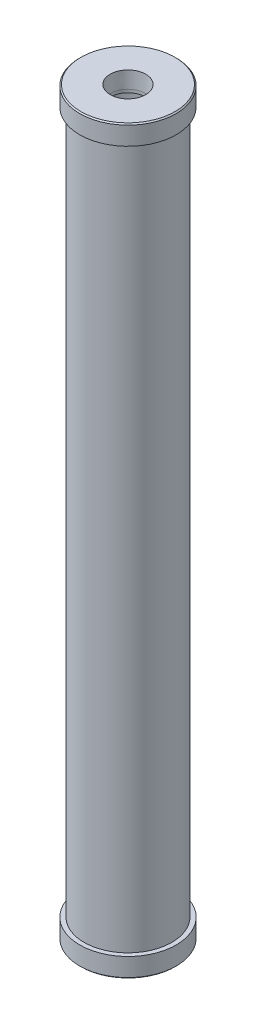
SolidWorks part; units mm, degrees
ref_plane "Front Plane" through (0, 0, 0) normal (0, 0, 1) x (1, 0, 0)
ref_plane "Top Plane" through (0, 0, 0) normal (0, 1, 0) x (1, 0, 0)
ref_plane "Right Plane" through (0, 0, 0) normal (1, 0, 0) x (0, 0, -1)
sketch "Sketch1" plane through (0, 0, 0) normal (0, 1, 0) x (1, 0, 0)
  circle A0 centre (0, 0) radius 57.15
  circle A1 centre (0, 0) radius 50.546
  dimension "D1" = 114.3
  dimension "D2" = 6.604
extrude "Boss-Extrude1" add sketch "Sketch1" along normal blind 965.2
sketch "Sketch2" plane through (0, 0, 0) normal (0, 1, 0) x (1, 0, 0)
  circle A0 centre (0, 0) radius 62.865
  dimension "D1" = 125.73
extrude "Boss-Extrude2" add sketch "Sketch2" along normal blind 25.4
hole_wizard "1-1/2 Rc Tapped Hole1" positions "Sketch4" profile "Sketch3" size "1-1/2" standard "BSI"
sketch "Sketch4" plane through (0, 0, 0) normal (0, 1, 0) x (1, 0, 0)
  point P0 (0, 0)
sketch "Sketch3" plane through (0, 0, 0) normal (1, 0, 0) x (0, 0, -1)
  line L0 (0, 0) -> (0, 46.3454)
  line L1 (22.6, 32.766) -> (0, 46.3454)
  line L2 (-22.6, 32.766) -> (0, 46.3454) construction
  line L3 (22.6, 32.766) -> (22.6, 21.336)
  line L4 (22.6, 21.336) -> (22.494, 21.336)
  line L5 (22.494, 21.336) -> (23.16, 0)
  line L6 (-22.494, 21.336) -> (-23.16, 0) construction
  line L7 (23.16, 0) -> (0, 0)
  line L8 (0, -6.35) -> (0, 107.95) construction
  line L11 (-22.6, 21.336) -> (-22.494, 21.336) construction
  dimension "Tap Drill Dia." = 45.2
  dimension "Tap Drill Depth" = 32.766
  dimension "Thread Dia." = 46.32
  dimension "Thread Angle" = 3.576
  dimension "Thread Depth" = 21.336
  dimension "Drill Angle" = 118
ref_plane "Plane1" through (0, 965.2, 0) normal (0, 1, 0) x (1, 0, 0)
sketch "Sketch5" plane through (0, 965.2, 0) normal (0, 1, 0) x (1, 0, 0)
  circle A0 centre (0, 0) radius 62.865
  dimension "D1" = 125.73
extrude "Boss-Extrude3" add sketch "Sketch5" against normal blind 25.4
hole_wizard "1-1/2 Rc Tapped Hole2" positions "Sketch7" profile "Sketch6" size "1-1/2" standard "BSI"
sketch "Sketch7" plane through (0, 965.2, 0) normal (0, 1, 0) x (1, 0, 0)
  point P0 (0, 0)
sketch "Sketch6" plane through (0, 965.2, 0) normal (1, 0, 0) x (0, 0, 1)
  line L0 (0, 0) -> (0, 46.3454)
  line L1 (22.6, 32.766) -> (0, 46.3454)
  line L2 (-22.6, 32.766) -> (0, 46.3454) construction
  line L3 (22.6, 32.766) -> (22.6, 21.336)
  line L4 (22.6, 21.336) -> (22.494, 21.336)
  line L5 (22.494, 21.336) -> (23.16, 0)
  line L6 (-22.494, 21.336) -> (-23.16, 0) construction
  line L7 (23.16, 0) -> (0, 0)
  line L8 (0, -6.35) -> (0, 107.95) construction
  line L11 (-22.6, 21.336) -> (-22.494, 21.336) construction
  dimension "Tap Drill Dia." = 45.2
  dimension "Tap Drill Depth" = 32.766
  dimension "Thread Dia." = 46.32
  dimension "Thread Angle" = 3.576
  dimension "Thread Depth" = 21.336
  dimension "Drill Angle" = 118
chamfer "Chamfer1" distance 1.524 angle 45 2 edges at (0, 0, 62.865) (0, 965.2, 62.865)
